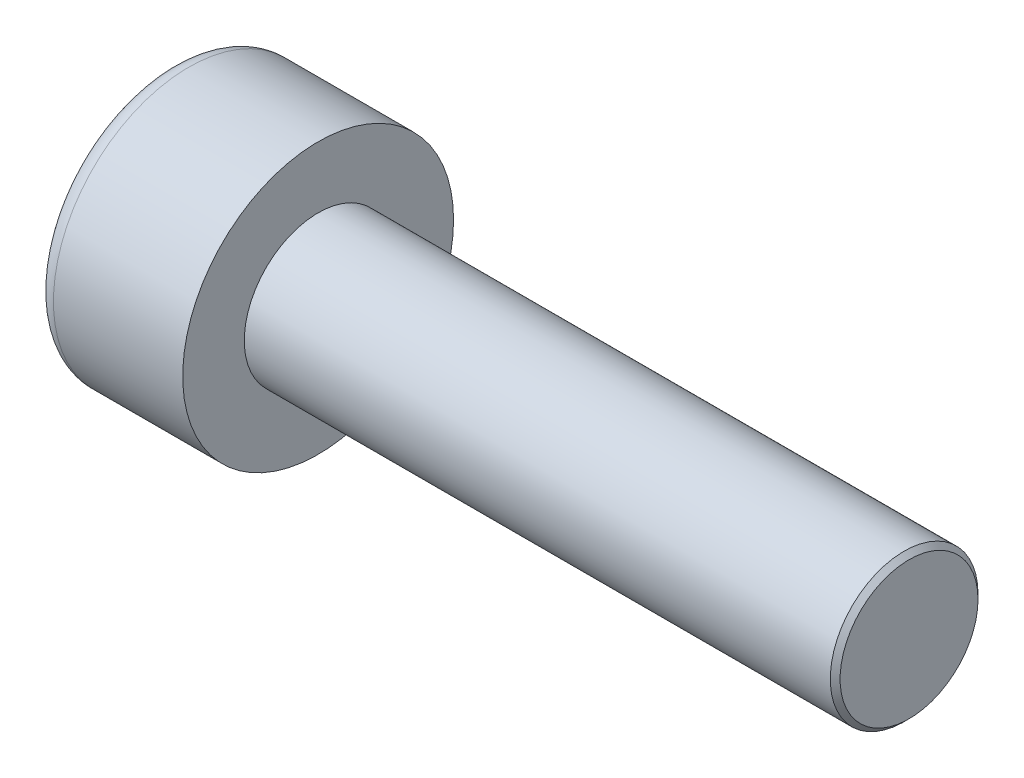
SolidWorks part; units mm, degrees
ref_plane "Front" through (0, 0, 0) normal (0, 0, 1) x (1, 0, 0)
ref_plane "Top" through (0, 0, 0) normal (0, 1, 0) x (1, 0, 0)
ref_plane "Right" through (0, 0, 0) normal (1, 0, 0) x (0, 0, -1)
other "Configuration Table"
sketch "Sketch1" plane through (0, 0, 0) normal (1, 0, 0) x (0, 0, -1)
  circle A0 centre (0, 0) radius 2.75
  dimension "dk" = 5.5
extrude "BaseHead" add sketch "Sketch1" along normal blind 3
sketch "Sketch2" plane through (3, 0, 0) normal (1, 0, 0) x (0, 0, -1)
  circle A0 centre (0, 0) radius 1.5
extrude "BaseBody" add sketch "Sketch2" along normal blind 12
sketch "Sketch3" plane through (0, 0, 0) normal (1, 0, 0) x (0, 0, -1)
  line L1 (1.4434, 0) -> (0.7217, 1.25)
  line L2 (0.7217, 1.25) -> (-0.7217, 1.25)
  line L3 (-0.7217, 1.25) -> (-1.4434, 0)
  line L4 (-1.4434, 0) -> (-0.7217, -1.25)
  line L5 (-0.7217, -1.25) -> (0.7217, -1.25)
  line L6 (0.7217, -1.25) -> (1.4434, 0)
  circle A0 centre (0, 0) radius 1.25 construction
  dimension "s" = 2.5
  dimension "e" = 2.8868
extrude "HexagonSocket" cut sketch "Sketch3" along normal blind 1.3
sketch "Sketch4" plane through (-4.1961, 0.75, 0) normal (0, 0, 1) x (-1, 0, 0)
  line L0 (-5.4961, 2) -> (-6.2178, 0.75)
  line L2 (-6.2178, 0.75) -> (-5.4961, 0.75)
  line L3 (-5.4961, 0.75) -> (-5.4961, 2)
  line L4 (-5.0351, 0.75) -> (0.839, 0.75) construction
  line L5 (-19.1961, 0.75) -> (-7.1961, 0.75) construction
  line L6 (-7.1961, 0.75) -> (-4.1961, 0.75) construction
  dimension "m" = 60
revolve "Cut-Revolve1" cut sketch "Sketch4" angle 360 about L4
fillet "HeadFillet" [suppressed] radius 0.1
fillet "TopFillet" radius 0.375 1 edges at (0, 0, -2.75)
chamfer "Chamfer1" distance 0.1 angle 45 1 edges at (15, 0, -1.5)
sketch "Sketch5" plane through (0, 0, 0) normal (0, 0, 1) x (1, 0, 0)
  line L0 (14.9, 1.2657) -> (15.0352, 1.5)
  line L1 (15.0352, 1.5) -> (15.0352, 1.7705)
  line L2 (15.0352, 1.7705) -> (14.7647, 1.7705)
  line L3 (14.7647, 1.7705) -> (14.7647, 1.5)
  line L4 (14.7647, 1.5) -> (14.9, 1.2657)
  line L5 (0, 0) -> (7.8886, 0) construction
  line L6 (14.9, -1.5) -> (14.9, 1.5) construction
revolve "Cut-Revolve10" [suppressed] cut sketch "Sketch5" angle 360 about L5
pattern_linear "LPattern10" [suppressed] count 37 spacing 0.3246 along (1, 0, 0)
equation "\"r1@TopFillet\" = \"d@Sketch2\" / 8"
equation "\"D1@Chamfer1\" = \"r@HeadFillet\""
equation "\"D1@Sketch5\" = \"d@Sketch2\""
equation "\"D2@Sketch5\" =  ( \"d@Sketch2\" - \"D2@ThreadCosmetic1\" )  / 2"
equation "\"D3@LPattern10\" = \"D2@Sketch5\" * 1.2"
equation "\"D1@LPattern10\" = \"b@ThreadCosmetic1\" / \"D3@LPattern10\""
